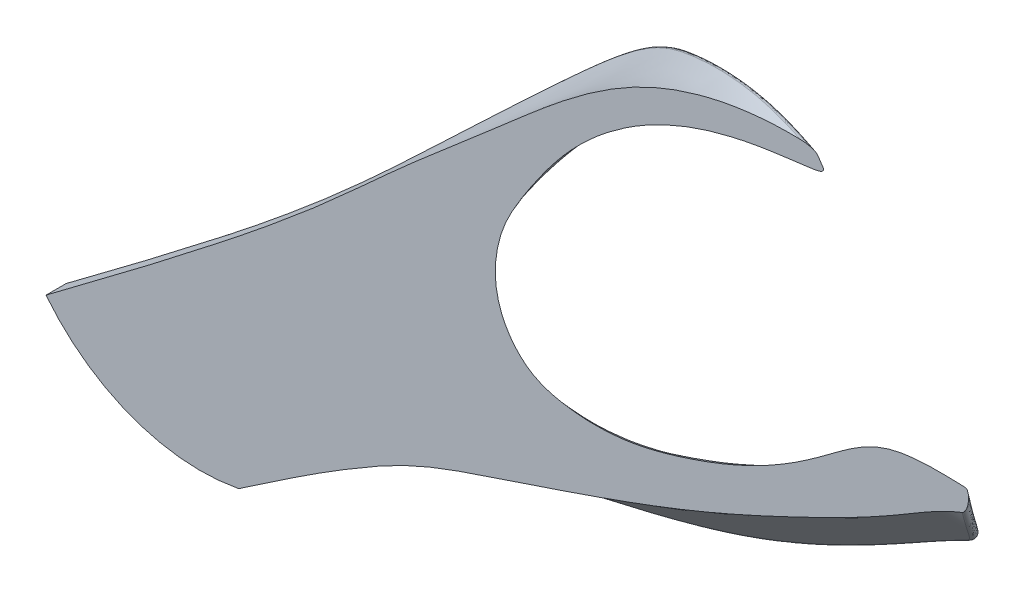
SolidWorks part; units mm, degrees
ref_plane "Front Plane" through (0, 0, 0) normal (0, 0, 1) x (1, 0, 0)
ref_plane "Top Plane" through (0, 0, 0) normal (0, 1, 0) x (1, 0, 0)
ref_plane "Right Plane" through (0, 0, 0) normal (1, 0, 0) x (0, 0, -1)
body saved out of another part "Stock-thumb-1"
